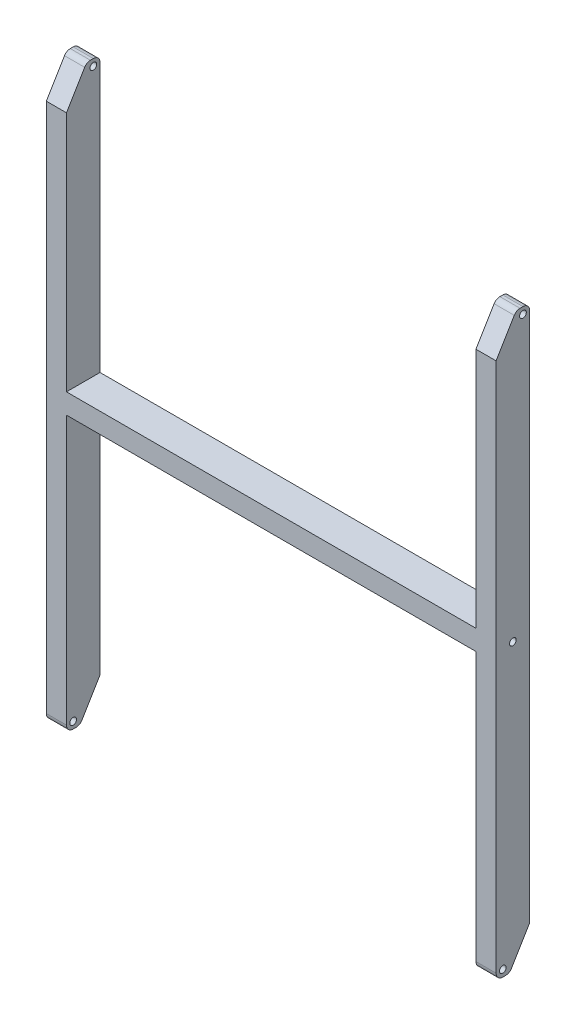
SolidWorks part; units mm, degrees
ref_plane "前视基准面" through (0, 0, 0) normal (0, 0, 1) x (1, 0, 0)
ref_plane "上视基准面" through (0, 0, 0) normal (0, 1, 0) x (1, 0, 0)
ref_plane "右视基准面" through (0, 0, 0) normal (1, 0, 0) x (0, 0, -1)
sketch "草图2" plane through (0, 0, 0) normal (0, 0, 1) x (1, 0, 0)
  line L0 (0, 0) -> (0, 153.8889) construction
  line L1 (0, 0) -> (-277.2222, 0) construction
  line L2 (-610, 30) -> (610, 30)
  line L3 (-610, 30) -> (-610, -30)
  line L4 (-610, -30) -> (610, -30)
  line L5 (610, 30) -> (610, -30)
  line L6 (-610, 30) -> (610, -30) construction
  line L7 (-610, -30) -> (610, 30) construction
  line L8 (-610, 750) -> (-670, 750)
  line L9 (-610, 750) -> (-610, -750)
  line L10 (-610, -750) -> (-670, -750)
  line L11 (-670, 750) -> (-670, -750)
  line L12 (610, -750) -> (670, -750)
  line L13 (610, 750) -> (610, -750)
  line L14 (610, 750) -> (670, 750)
  line L15 (610, 30) -> (610, -30)
  line L16 (670, 750) -> (670, -750)
  dimension "D1" = 60
  dimension "D2" = 1500
  dimension "D3" = 1340
extrude "凸台-拉伸1" add sketch "草图2" along normal mid plane 100 contours L8 L11 L10 L9 L3 | L5 L2 L3 L4 | L16 L14 L13 L5 L12
sketch "草图4" plane through (0, 30, 0) normal (0, 1, 0) x (1, 0, 0)
  line L0 (0, 0) -> (-400, 0) construction
  line L2 (-420, 30) -> (-380, 30)
  line L3 (-420, 30) -> (-420, -30)
  line L4 (-420, -30) -> (-380, -30)
  line L5 (-380, 30) -> (-380, -30)
  line L6 (-420, 30) -> (-380, -30) construction
  line L7 (-420, -30) -> (-380, 30) construction
  dimension "D1" = 40
  dimension "D2" = 60
  dimension "D3" = 400
extrude "凸台-拉伸2" add sketch "草图4" along normal blind 80
sketch "草图5" plane through (-380, 0, 0) normal (1, 0, 0) x (0, 0, -1)
  line L0 (0, 110) -> (0, 90) construction
  line L1 (-30, 110) -> (30, 110) construction
  circle A0 centre (0, 90) radius 10
  dimension "D1" = 20
  dimension "D2" = 20
extrude "切除-拉伸1" cut sketch "草图5" against normal blind 80
fillet "圆角1" radius 30 2 edges at (-400, 110, -30) (-400, 110, 30)
sketch "草图6" plane through (0, 0, 30) normal (0, 0, 1) x (1, 0, 0)
  line L0 (-400, 110) -> (-400, 13.3706) construction
  line L1 (-420, 110) -> (-380, 110) construction
  line L2 (-610, 30) -> (610, 30) construction
  line L3 (-410, 110) -> (-390, 110)
  line L4 (-410, 110) -> (-410, 30)
  line L5 (-410, 30) -> (-390, 30)
  line L6 (-390, 110) -> (-390, 30)
  line L7 (-410, 110) -> (-390, 30) construction
  line L8 (-410, 30) -> (-390, 110) construction
  point P4 (-400, 70)
  dimension "D1" = 20
extrude "切除-拉伸2" cut sketch "草图6" against normal blind 80
sketch "草图7" plane through (-610, 0, 0) normal (1, 0, 0) x (0, 0, -1)
  line L0 (-50, 750) -> (10, 850)
  line L1 (10, 850) -> (50, 850)
  line L2 (50, 850) -> (50, 750)
  line L3 (50, 750) -> (-50, 750)
  line L4 (30, 850) -> (30, 830) construction
  line L5 (-50, -750) -> (-50, -850)
  line L6 (-50, 750) -> (-50, -750) construction
  line L7 (-50, -850) -> (-10, -850)
  line L8 (-10, -850) -> (50, -750)
  line L9 (50, 750) -> (50, -750) construction
  line L10 (50, -750) -> (-50, -750)
  line L11 (-30, -850) -> (-30, -830) construction
  line L12 (-50, -750) -> (50, -750) construction
  circle A0 centre (30, 830) radius 10
  circle A1 centre (-30, -830) radius 10
  point P22 (0, -750)
  dimension "D1" = 20
  dimension "D2" = 100
  dimension "D3" = 40
  dimension "D4" = 20
extrude "凸台-拉伸3" add sketch "草图7" against normal blind 60
fillet "圆角2" radius 20 4 edges at (-640, 850, -10) (-640, 850, -50) (-640, -850, 10) (-640, -850, 50)
mirror "镜向1" about plane through (0, 0, 0) normal (1, 0, 0) of "圆角2", "凸台-拉伸3", "切除-拉伸2", "圆角1", "切除-拉伸1", "凸台-拉伸2"
sketch "草图8" plane through (0, 0, 0) normal (1, 0, 0) x (0, 0, -1)
  circle A0 centre (0, 0) radius 10
  dimension "D1" = 20
extrude "切除-拉伸3" cut sketch "草图8" against normal mid plane 1500
sketch "草图9" plane through (0, 0, 50) normal (0, 0, 1) x (1, 0, 0)
  line L0 (-610, 30) -> (610, 30) construction
  line L1 (-607.0487, 30) -> (538.4879, 30)
  line L2 (-607.0487, 30) -> (-607.0487, 267.1014)
  line L3 (-607.0487, 267.1014) -> (538.4879, 267.1014)
  line L4 (538.4879, 30) -> (538.4879, 267.1014)
extrude "切除-拉伸4" cut sketch "草图9" against normal through all
